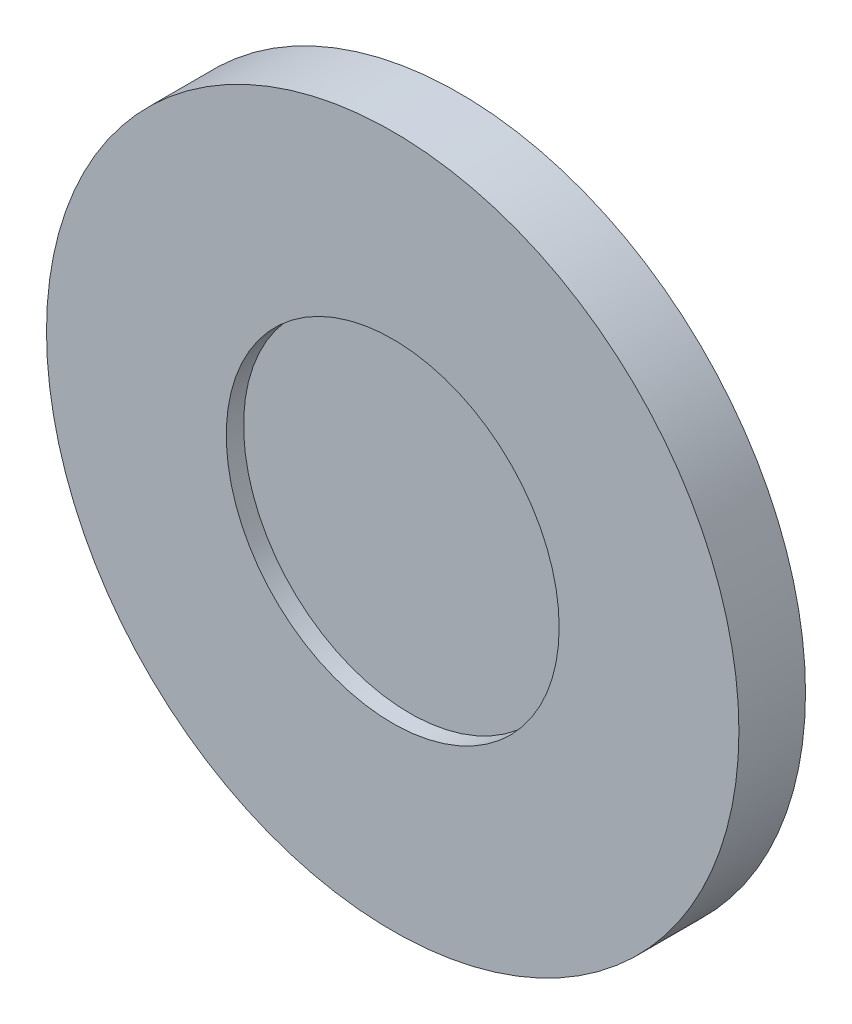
SolidWorks part; units mm, degrees
ref_plane "前视基准面" through (0, 0, 0) normal (0, 0, 1) x (1, 0, 0)
ref_plane "上视基准面" through (0, 0, 0) normal (0, 1, 0) x (1, 0, 0)
ref_plane "右视基准面" through (0, 0, 0) normal (1, 0, 0) x (0, 0, -1)
other "Configuration Table"
sketch "草图1" plane through (0, 0, 0) normal (0, 0, 1) x (1, 0, 0)
  circle A0 centre (0, 0) radius 52
extrude "01_DISC_D104" add sketch "草图1" along normal blind 10
sketch "草图2" plane through (0, 0, 0) normal (0, 0, 1) x (1, 0, 0)
  line L0 (27.9844, 37.1366) -> (23.4708, 31.1468)
  line L1 (38.7093, 4.7529) -> (46.1534, 5.6669)
  arc A0 (46.1534, 5.6669) -> (27.9844, 37.1366) centre (0, 0) ccw
  arc A1 (23.4708, 31.1468) -> (38.7093, 4.7529) centre (0, 0) cw
extrude "02_FOOT_1" add sketch "草图2" against normal blind 1.2
sketch "草图3" plane through (0, 0, 0) normal (0, 0, 1) x (1, 0, 0)
  line L0 (-46.1534, 5.6669) -> (-38.7093, 4.7529)
  line L1 (-23.4708, 31.1468) -> (-27.9844, 37.1366)
  arc A0 (-27.9844, 37.1366) -> (-46.1534, 5.6669) centre (0, 0) ccw
  arc A1 (-38.7093, 4.7529) -> (-23.4708, 31.1468) centre (0, 0) cw
extrude "02_FOOT_2" add sketch "草图3" against normal blind 1.2
sketch "草图4" plane through (0, 0, 0) normal (0, 0, 1) x (1, 0, 0)
  line L0 (18.169, -42.8035) -> (15.2385, -35.8997)
  line L1 (-15.2385, -35.8997) -> (-18.169, -42.8035)
  arc A0 (-18.169, -42.8035) -> (18.169, -42.8035) centre (0, 0) ccw
  arc A1 (15.2385, -35.8997) -> (-15.2385, -35.8997) centre (0, 0) cw
extrude "02_FOOT_3" add sketch "草图4" against normal blind 1.2
ref_plane "Plane_Top" through (0, 0, 10) normal (0, 0, 1) x (1, 0, 0)
sketch "草图5" plane through (0, 0, 10) normal (0, 0, 1) x (1, 0, 0)
  circle A0 centre (0, 0) radius 25
extrude "03_RECESS_D50" cut sketch "草图5" against normal blind 2.6
sketch "草图6" plane through (0, 0, 0) normal (0, 0, 1) x (1, 0, 0)
  circle A0 centre (0, 12) radius 3.25
extrude "04_SCREW_SEAT_1" cut sketch "草图6" along normal blind 0.3
sketch "草图7" plane through (0, 0, 0) normal (0, 0, 1) x (1, 0, 0)
  line L0 (-3.25, 11.65) -> (3.25, 11.65)
  line L1 (3.25, 11.65) -> (3.25, 12.35)
  line L2 (3.25, 12.35) -> (-3.25, 12.35)
  line L3 (-3.25, 12.35) -> (-3.25, 11.65)
extrude "04_SCREW_X_1_1" cut sketch "草图7" along normal blind 0.45
sketch "草图8" plane through (0, 0, 0) normal (0, 0, 1) x (1, 0, 0)
  line L0 (-0.35, 8.75) -> (0.35, 8.75)
  line L1 (0.35, 8.75) -> (0.35, 15.25)
  line L2 (0.35, 15.25) -> (-0.35, 15.25)
  line L3 (-0.35, 15.25) -> (-0.35, 8.75)
extrude "04_SCREW_X_1_2" cut sketch "草图8" along normal blind 0.45
sketch "草图9" plane through (0, 0, 0) normal (0, 0, 1) x (1, 0, 0)
  circle A0 centre (-10.3923, -6) radius 3.25
extrude "04_SCREW_SEAT_2" cut sketch "草图9" along normal blind 0.3
sketch "草图10" plane through (0, 0, 0) normal (0, 0, 1) x (1, 0, 0)
  line L0 (-13.6423, -6.35) -> (-7.1423, -6.35)
  line L1 (-7.1423, -6.35) -> (-7.1423, -5.65)
  line L2 (-7.1423, -5.65) -> (-13.6423, -5.65)
  line L3 (-13.6423, -5.65) -> (-13.6423, -6.35)
extrude "04_SCREW_X_2_1" cut sketch "草图10" along normal blind 0.45
sketch "草图11" plane through (0, 0, 0) normal (0, 0, 1) x (1, 0, 0)
  line L0 (-10.7423, -9.25) -> (-10.0423, -9.25)
  line L1 (-10.0423, -9.25) -> (-10.0423, -2.75)
  line L2 (-10.0423, -2.75) -> (-10.7423, -2.75)
  line L3 (-10.7423, -2.75) -> (-10.7423, -9.25)
extrude "04_SCREW_X_2_2" cut sketch "草图11" along normal blind 0.45
sketch "草图12" plane through (0, 0, 0) normal (0, 0, 1) x (1, 0, 0)
  circle A0 centre (10.3923, -6) radius 3.25
extrude "04_SCREW_SEAT_3" cut sketch "草图12" along normal blind 0.3
sketch "草图13" plane through (0, 0, 0) normal (0, 0, 1) x (1, 0, 0)
  line L0 (7.1423, -6.35) -> (13.6423, -6.35)
  line L1 (13.6423, -6.35) -> (13.6423, -5.65)
  line L2 (13.6423, -5.65) -> (7.1423, -5.65)
  line L3 (7.1423, -5.65) -> (7.1423, -6.35)
extrude "04_SCREW_X_3_1" cut sketch "草图13" along normal blind 0.45
sketch "草图14" plane through (0, 0, 0) normal (0, 0, 1) x (1, 0, 0)
  line L0 (10.0423, -9.25) -> (10.7423, -9.25)
  line L1 (10.7423, -9.25) -> (10.7423, -2.75)
  line L2 (10.7423, -2.75) -> (10.0423, -2.75)
  line L3 (10.0423, -2.75) -> (10.0423, -9.25)
extrude "04_SCREW_X_3_2" cut sketch "草图14" along normal blind 0.45
